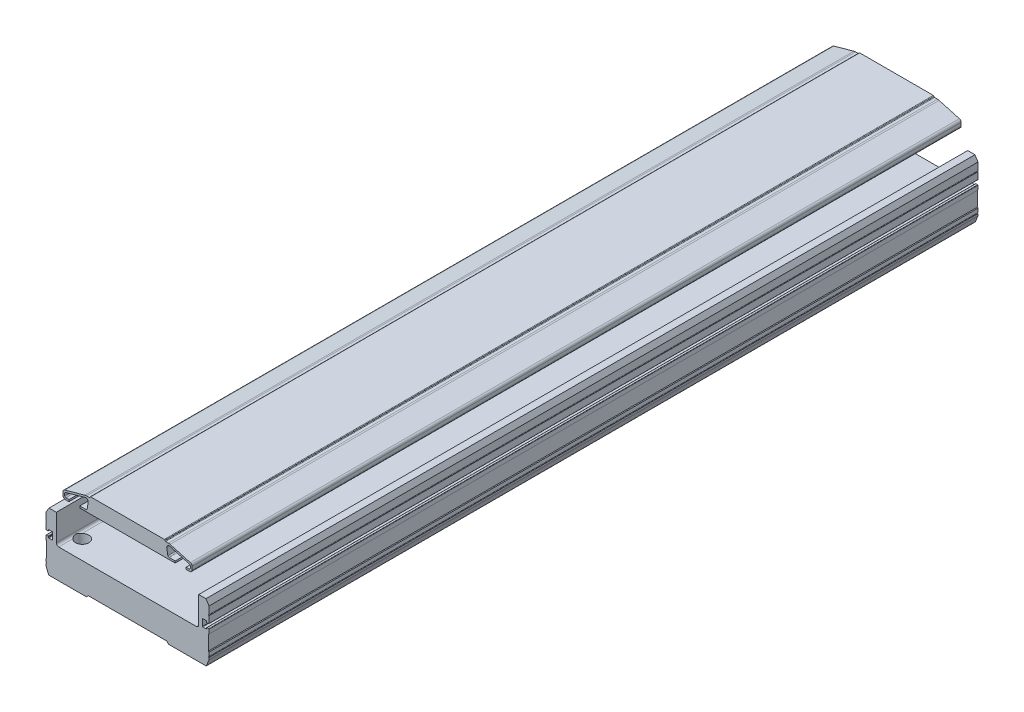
SolidWorks part; units mm, degrees
ref_plane "前视基准面" through (0, 0, 0) normal (0, 0, 1) x (1, 0, 0)
ref_plane "上视基准面" through (0, 0, 0) normal (0, 1, 0) x (1, 0, 0)
ref_plane "右视基准面" through (0, 0, 0) normal (1, 0, 0) x (0, 0, -1)
sketch "草图1" plane through (0, 0, 0) normal (0, 0, 1) x (1, 0, 0)
  line B0 (-39.5, 59.4) -> (39.5, 59.4)
  line B1 (39.5, 59.4) -> (39.5, 60.9)
  line B2 (39.5, 60.9) -> (34.4, 60.9)
  line B3 (33.4138, 61.7343) -> (32.5361, 66.9593)
  line B4 (35.0485, 69.2164) -> (51.27, 64.6675)
  line B5 (52, 63.7046) -> (52, 61.9)
  line B6 (51, 60.9) -> (48.5, 60.9)
  line B7 (48.5, 60.9) -> (48.5, 59.4)
  line B8 (48.5, 59.4) -> (51.5, 59.4)
  line B9 (53.5, 61.4) -> (53.5, 64.0837)
  line B10 (52.04, 66.0094) -> (35.2622, 70.7143)
  line B11 (33.9122, 70.9) -> (31.5, 70.9)
  line B12 (30.5, 71.9) -> (-30.5, 71.9)
  line B13 (-31.5, 70.9) -> (-33.9122, 70.9)
  line B14 (-35.2622, 70.7143) -> (-52.04, 66.0094)
  line B15 (-53.5, 64.0837) -> (-53.5, 61.4)
  line B16 (-51.5, 59.4) -> (-48.5, 59.4)
  line B17 (-48.5, 59.4) -> (-48.5, 60.9)
  line B18 (-48.5, 60.9) -> (-51, 60.9)
  line B19 (-52, 61.9) -> (-52, 63.7046)
  line B20 (-51.27, 64.6675) -> (-35.0485, 69.2164)
  line B21 (-32.5361, 66.9593) -> (-33.4138, 61.7343)
  line B22 (-34.4, 60.9) -> (-39.5, 60.9)
  line B23 (-39.5, 60.9) -> (-39.5, 59.4)
  line B24 (-67, 22) -> (-67, 10)
  line B25 (-67, 10) -> (-67.5, 9.5)
  line B26 (-67.5, 9.5) -> (-67.5, 6.375)
  line B27 (-67.5, 5.625) -> (-67.5, 4.3812)
  line B28 (-67.36, 3.6469) -> (-65.5064, -1.0289)
  line B29 (-65.16, -1.6) -> (-34.1, -1.6)
  line B30 (-34.1, -1.6) -> (-32.5, 0)
  line B31 (-32.5, 0) -> (32.5, 0)
  line B32 (32.5, 0) -> (34.1, -1.6)
  line B33 (34.1, -1.6) -> (65.16, -1.6)
  line B34 (65.5064, -1.0289) -> (67.36, 3.6469)
  line B35 (67.5, 4.3812) -> (67.5, 5.625)
  line B36 (67.5, 6.375) -> (67.5, 9.5)
  line B37 (67.5, 9.5) -> (67, 10)
  line B38 (67, 10) -> (67, 22)
  line B39 (67, 22) -> (67.5, 22.5)
  line B40 (67.5, 22.5) -> (67.5, 25.9)
  line B41 (67.2, 26.2) -> (65.8, 26.2)
  line B42 (65.5, 25.9) -> (65.5, 25.3)
  line B43 (65.2, 25) -> (62.3, 25)
  line B44 (62, 25.3) -> (62, 30.7)
  line B45 (62.3, 31) -> (65.2, 31)
  line B46 (65.5, 30.7) -> (65.5, 30.1)
  line B47 (65.8, 29.8) -> (67.2, 29.8)
  line B48 (67.5, 30.1) -> (67.5, 35.625)
  line B49 (67.5, 36.375) -> (67.5, 42.6)
  line B50 (67.5, 42.6) -> (65, 46.6)
  line B51 (65, 46.6) -> (59, 46.6)
  line B52 (59, 46.6) -> (59, 24.7)
  line B53 (57, 22.7) -> (-57, 22.7)
  line B54 (-59, 24.7) -> (-59, 46.6)
  line B55 (-59, 46.6) -> (-65, 46.6)
  line B56 (-65, 46.6) -> (-67.5, 42.6)
  line B57 (-67.5, 42.6) -> (-67.5, 36.375)
  line B58 (-67.5, 35.625) -> (-67.5, 30.1)
  line B59 (-67.2, 29.8) -> (-65.8, 29.8)
  line B60 (-65.5, 30.1) -> (-65.5, 30.7)
  line B61 (-65.2, 31) -> (-62.3, 31)
  line B62 (-62, 30.7) -> (-62, 25.3)
  line B63 (-62.3, 25) -> (-65.2, 25)
  line B64 (-65.5, 25.3) -> (-65.5, 25.9)
  line B65 (-65.8, 26.2) -> (-67.2, 26.2)
  line B66 (-67.5, 25.9) -> (-67.5, 22.5)
  line B67 (-67.5, 22.5) -> (-67, 22)
  arc B68 (33.4138, 61.7343) -> (34.4, 60.9) centre (34.4, 61.9) ccw
  arc B69 (35.0485, 69.2164) -> (32.5361, 66.9593) centre (34.5085, 67.2906) ccw
  arc B70 (52, 63.7046) -> (51.27, 64.6675) centre (51, 63.7046) ccw
  arc B71 (51, 60.9) -> (52, 61.9) centre (51, 61.9) ccw
  arc B72 (51.5, 59.4) -> (53.5, 61.4) centre (51.5, 61.4) ccw
  arc B73 (53.5, 64.0837) -> (52.04, 66.0094) centre (51.5, 64.0837) ccw
  arc B74 (35.2622, 70.7143) -> (33.9122, 70.9) centre (33.9122, 65.9) ccw
  arc B75 (31, 71.4) -> (31.5, 70.9) centre (31.5, 71.4) ccw
  arc B76 (31, 71.4) -> (30.5, 71.9) centre (30.5, 71.4) ccw
  arc B77 (-30.5, 71.9) -> (-31, 71.4) centre (-30.5, 71.4) ccw
  arc B78 (-31.5, 70.9) -> (-31, 71.4) centre (-31.5, 71.4) ccw
  arc B79 (-33.9122, 70.9) -> (-35.2622, 70.7143) centre (-33.9122, 65.9) ccw
  arc B80 (-52.04, 66.0094) -> (-53.5, 64.0837) centre (-51.5, 64.0837) ccw
  arc B81 (-53.5, 61.4) -> (-51.5, 59.4) centre (-51.5, 61.4) ccw
  arc B82 (-52, 61.9) -> (-51, 60.9) centre (-51, 61.9) ccw
  arc B83 (-51.27, 64.6675) -> (-52, 63.7046) centre (-51, 63.7046) ccw
  arc B84 (-32.5361, 66.9593) -> (-35.0485, 69.2164) centre (-34.5085, 67.2906) ccw
  arc B85 (-34.4, 60.9) -> (-33.4138, 61.7343) centre (-34.4, 61.9) ccw
  arc B86 (-67.5, 5.625) -> (-67.5, 6.375) centre (-67.5, 6) ccw
  arc B87 (-67.5, 4.3812) -> (-67.36, 3.6469) centre (-65.5, 4.382) ccw
  arc B88 (-65.5064, -1.0289) -> (-65.16, -1.6) centre (-63.6472, -0.2918) ccw
  arc B89 (65.16, -1.6) -> (65.5064, -1.0289) centre (63.6472, -0.2918) ccw
  arc B90 (67.36, 3.6469) -> (67.5, 4.3812) centre (65.5, 4.382) ccw
  arc B91 (67.5, 6.375) -> (67.5, 5.625) centre (67.5, 6) ccw
  arc B92 (67.5, 25.9) -> (67.2, 26.2) centre (67.2, 25.9) ccw
  arc B93 (65.8, 26.2) -> (65.5, 25.9) centre (65.8, 25.9) ccw
  arc B94 (65.2, 25) -> (65.5, 25.3) centre (65.2, 25.3) ccw
  arc B95 (62, 25.3) -> (62.3, 25) centre (62.3, 25.3) ccw
  arc B96 (62.3, 31) -> (62, 30.7) centre (62.3, 30.7) ccw
  arc B97 (65.5, 30.7) -> (65.2, 31) centre (65.2, 30.7) ccw
  arc B98 (65.5, 30.1) -> (65.8, 29.8) centre (65.8, 30.1) ccw
  arc B99 (67.2, 29.8) -> (67.5, 30.1) centre (67.2, 30.1) ccw
  arc B100 (67.5, 36.375) -> (67.5, 35.625) centre (67.5, 36) ccw
  arc B101 (57, 22.7) -> (59, 24.7) centre (57, 24.7) ccw
  arc B102 (-59, 24.7) -> (-57, 22.7) centre (-57, 24.7) ccw
  arc B103 (-67.5, 35.625) -> (-67.5, 36.375) centre (-67.5, 36) ccw
  arc B104 (-67.5, 30.1) -> (-67.2, 29.8) centre (-67.2, 30.1) ccw
  arc B105 (-65.8, 29.8) -> (-65.5, 30.1) centre (-65.8, 30.1) ccw
  arc B106 (-65.2, 31) -> (-65.5, 30.7) centre (-65.2, 30.7) ccw
  arc B107 (-62, 30.7) -> (-62.3, 31) centre (-62.3, 30.7) ccw
  arc B108 (-62.3, 25) -> (-62, 25.3) centre (-62.3, 25.3) ccw
  arc B109 (-65.5, 25.3) -> (-65.2, 25) centre (-65.2, 25.3) ccw
  arc B110 (-65.5, 25.9) -> (-65.8, 26.2) centre (-65.8, 25.9) ccw
  arc B111 (-67.2, 26.2) -> (-67.5, 25.9) centre (-67.2, 25.9) ccw
sketch_block_instance "块4-1"
sketch_block "块4"
extrude "凸台-拉伸1" add sketch "草图1" against normal blind 637
hole_wizard "打孔尺寸(%根据)内六角圆柱头螺钉的类型1" positions "草图3" profile "草图4" counterbore size "M6" standard "GB"
sketch "草图3" plane through (0, 46.6, 0) normal (0, 1, 0) x (1, 0, 0)
  line L4 (34.1, 637) -> (65.16, 637) construction
  line L5 (0, 637) -> (0, 1140.2602) construction
  line L6 (-32.5, 637) -> (32.5, 637) construction
  point P0 (-53, 565.5)
  point P2 (53, 565.5)
  point P13 (53, 415.5)
  point P15 (-53, 415.5)
  point P22 (53, 215.5)
  point P24 (-53, 215.5)
  point P25 (53, 15.5)
  point P27 (-53, 15.5)
  point P29 (53, -184.5)
  point P31 (-53, -184.5)
  point P33 (53, -384.5)
  point P35 (-53, -384.5)
  point P45 (-53, -584.5)
  point P47 (53, -584.5)
  dimension "D1" = 106
  dimension "D2" = 200
  dimension "D3" = 71.5
  dimension "D4" = 150
  dimension "D5" = 200
  dimension "D6" = 200
  dimension "D7" = 200
  dimension "D8" = 200
sketch "草图4" plane through (-53, 46.6, -565.5) normal (1, 0, 0) x (0, 0, 1)
  line L0 (0, 0) -> (0, 48.2)
  line L1 (0, 48.2) -> (3.5, 48.2)
  line L3 (3.5, 48.2) -> (3.5, 41)
  line L4 (3.5, 41) -> (5.5, 41)
  line L5 (5.5, 41) -> (5.5, 0)
  line L7 (5.5, 0) -> (0, 0)
  line L11 (0, -6.35) -> (0, 107.95) construction
  dimension "通孔孔直径" = 7
  dimension "通孔孔深度" = 48.2
  dimension "柱形沉头孔直径" = 11
  dimension "柱形沉头孔深度" = 41
hole_wizard "M6 螺纹孔0" positions "草图5" profile "草图6" tap size "M6" standard "GB"
sketch "草图5" plane through (0, -1.6, 0) normal (0, -1, 0) x (-1, 0, 0)
  line L0 (53, 565.5) -> (53, 575.5) construction
  line L1 (-53, 565.5) -> (-53, 575.5) construction
  line L4 (65.16, 637) -> (34.1, 637) construction
  point P0 (53, 575.5)
  point P2 (-53, 575.5)
  point P12 (53, 425.5)
  point P14 (-53, 425.5)
  point P19 (-53, 225.5)
  point P21 (53, 225.5)
  point P23 (-53, 25.5)
  point P25 (53, 25.5)
  point P27 (-53, -174.5)
  point P29 (53, -174.5)
  point P31 (-53, -374.5)
  point P33 (53, -374.5)
  point P36 (53, -574.5)
  point P38 (-53, -574.5)
  dimension "D1" = 61.5
  dimension "D2" = 150
  dimension "D3" = 200
  dimension "D4" = 200
  dimension "D5" = 200
  dimension "D6" = 200
  dimension "D7" = 200
sketch "草图6" plane through (-53, -1.6, -575.5) normal (1, 0, 0) x (0, 0, -1)
  line L0 (0, 0) -> (0, 16.5022)
  line L1 (0, 16.5022) -> (2.5, 15)
  line L2 (2.5, 15) -> (2.5, 0)
  line L5 (2.5, 0) -> (0, 0)
  line L10 (0, 16.5022) -> (-2.5, 15) construction
  line L11 (0, -6.35) -> (0, 107.95) construction
  dimension "螺纹孔钻头直径" = 5
  dimension "螺纹孔钻头深度" = 15
  dimension "导头角度" = 118
